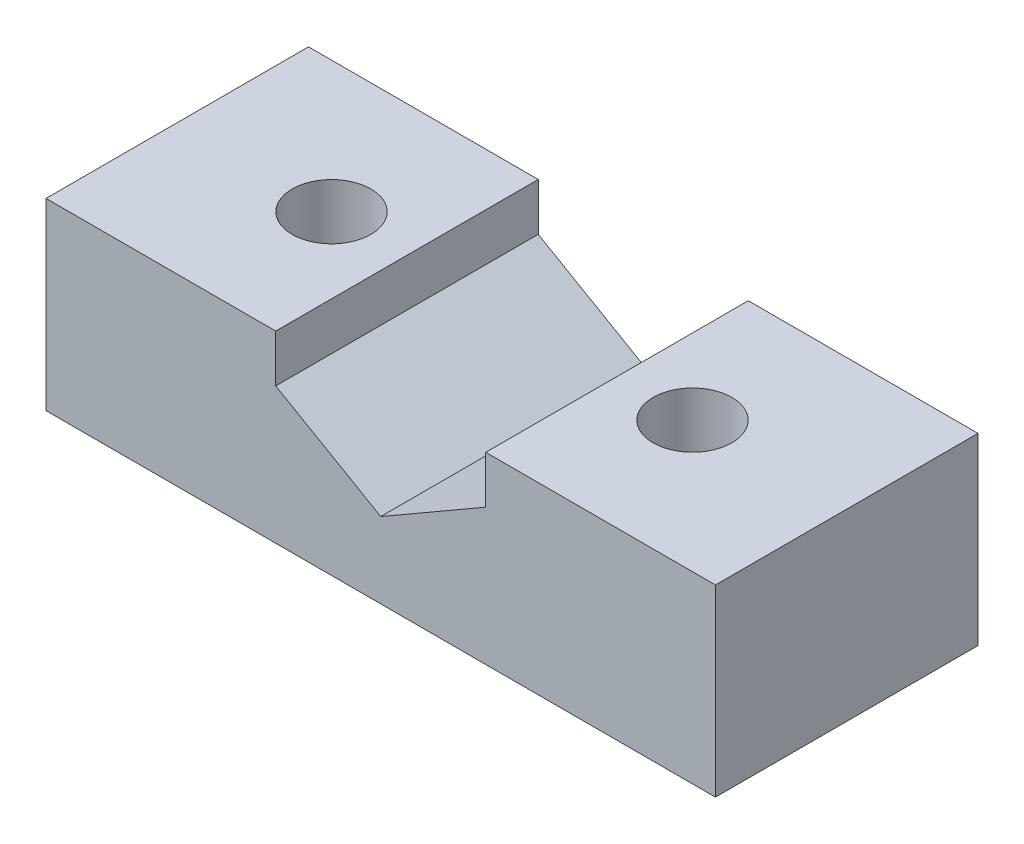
SolidWorks part; units mm, degrees
ref_plane "Front Plane" through (0, 0, 0) normal (0, 0, 1) x (1, 0, 0)
ref_plane "Top Plane" through (0, 0, 0) normal (0, 1, 0) x (1, 0, 0)
ref_plane "Right Plane" through (0, 0, 0) normal (1, 0, 0) x (0, 0, -1)
sketch "Sketch1" plane through (0, 0, 0) normal (0, 1, 0) x (1, 0, 0)
  line L1 (-12.75, -5) -> (12.75, -5)
  line L2 (-12.75, -5) -> (-12.75, 5)
  line L3 (-12.75, 5) -> (12.75, 5)
  line L4 (12.75, -5) -> (12.75, 5)
  line L5 (-12.75, -5) -> (12.75, 5) construction
  line L6 (-12.75, 5) -> (12.75, -5) construction
  point P0 (0, 0)
  dimension "D1" = 10
  dimension "D2" = 25.5
extrude "Boss-Extrude1" add sketch "Sketch1" along normal blind 7 separate body
sketch "Sketch2" plane through (0, 0, 5) normal (0, 0, 1) x (1, 0, 0)
  line L0 (-12.75, 7) -> (12.75, 7) construction
  line L1 (4, 5.1906) -> (4, 9.8094)
  line L2 (4, 9.8094) -> (0, 12.1188)
  line L3 (0, 12.1188) -> (-4, 9.8094)
  line L4 (-4, 9.8094) -> (-4, 5.1906)
  line L5 (-4, 5.1906) -> (0, 2.8812)
  line L6 (0, 2.8812) -> (4, 5.1906)
  circle A0 centre (0, 7.5) radius 4 construction
  dimension "D1" = 8
  dimension "D2" = 0.5
extrude "Cut-Extrude1" cut sketch "Sketch2" against normal through all
sketch "Sketch3" plane through (0, 7, 0) normal (0, 1, 0) x (1, 0, 0)
  line L2 (-4, 0) -> (-9.75, 0) construction
  line L3 (-4, -5) -> (-4, 5) construction
  line L4 (-12.75, 5) -> (-12.75, -5) construction
  circle A3 centre (-6.875, 0) radius 1.5
  point P18 (0, 0)
  point P19 (-5.7645, 0)
  point P20 (-6.875, 0)
  dimension "D1" = 3
  dimension "D3" = 3
extrude "Cut-Extrude2" cut sketch "Sketch3" against normal through all
mirror "Mirror1" about plane through (0, 0, 0) normal (1, 0, 0) of "Cut-Extrude2"
